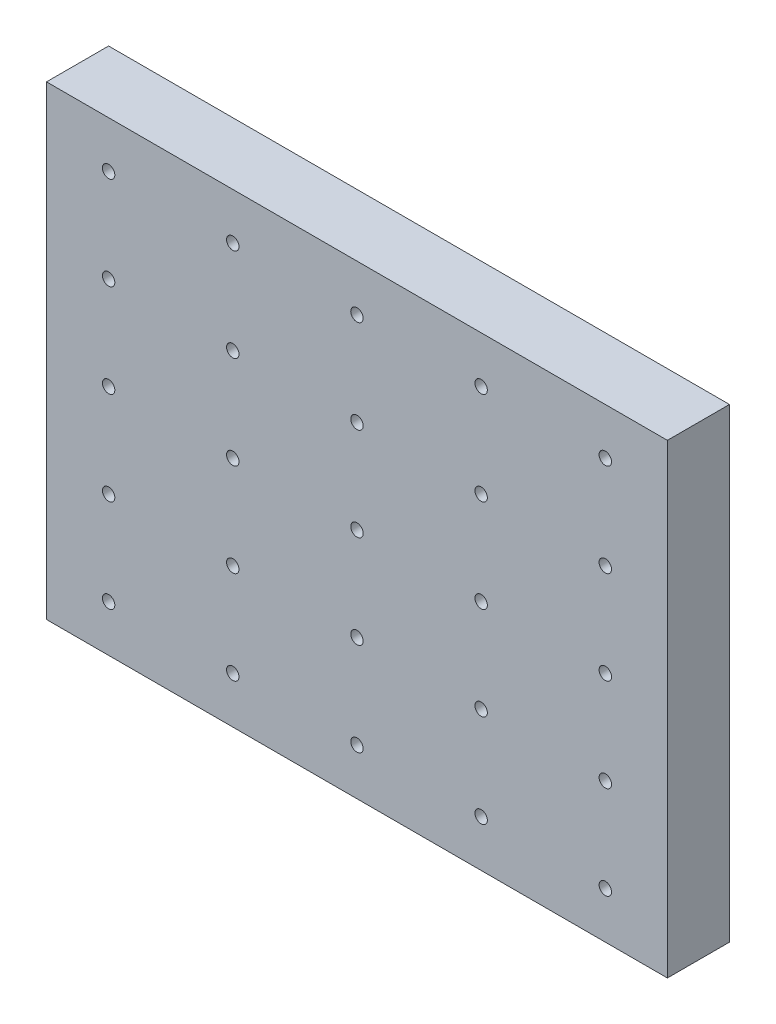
SolidWorks part; units mm, degrees
ref_plane "Plan de face" through (0, 0, 0) normal (0, 0, 1) x (1, 0, 0)
ref_plane "Plan de dessus" through (0, 0, 0) normal (0, 1, 0) x (1, 0, 0)
ref_plane "Plan de droite" through (0, 0, 0) normal (1, 0, 0) x (0, 0, -1)
sketch "Esquisse1" plane through (0, 0, 0) normal (0, 0, 1) x (1, 0, 0)
  line L1 (0, 0) -> (200, 0)
  line L2 (0, 0) -> (0, 150)
  line L3 (0, 150) -> (200, 150)
  line L4 (200, 0) -> (200, 150)
  dimension "D1" = 200
  dimension "D2" = 150
extrude "Boss.-Extru.1" add sketch "Esquisse1" along normal blind 20
sketch "Esquisse4" plane through (0, 0, 0) normal (0, 0, -1) x (-1, 0, 0)
  line L0 (0, 0) -> (-200, 0) construction
  line L1 (0, 150) -> (0, 0) construction
  circle A0 centre (-20, 15) radius 2
  dimension "D1" = 4
  dimension "D2" = 15
  dimension "D3" = 20
extrude "Enlèv. mat.-Extru.2" cut sketch "Esquisse4" against normal blind 20
pattern_linear "Répétition linéaire1" count 5 spacing 40 along (1, 0, 0) count 5 spacing 30 along (0, 1, 0) of "Enlèv. mat.-Extru.2"
